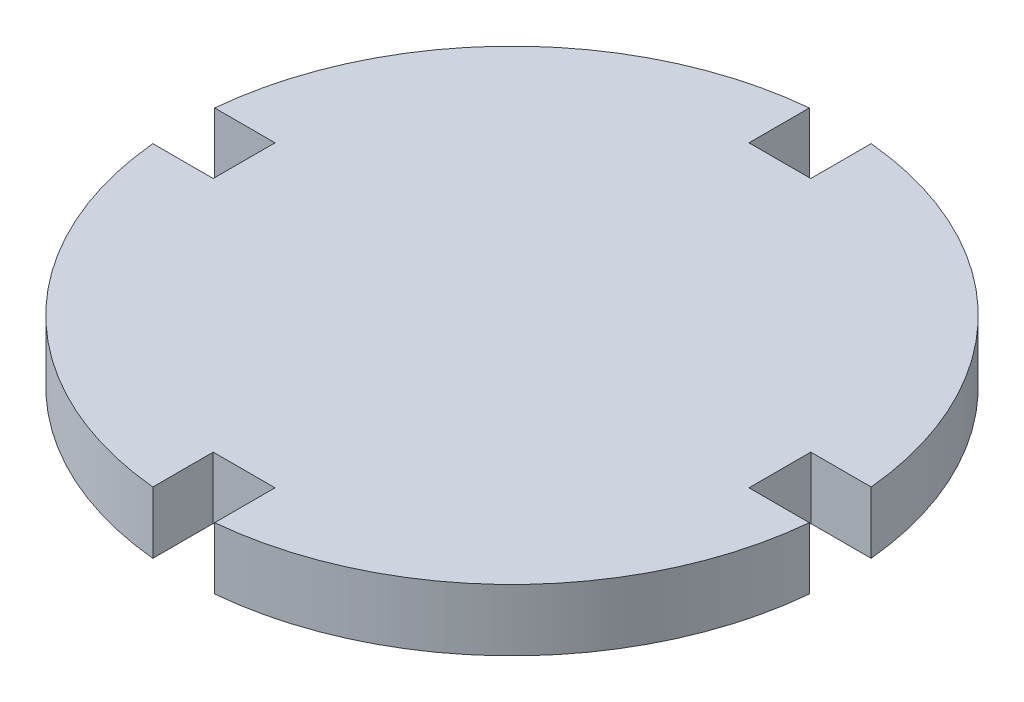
SolidWorks part; units mm, degrees
ref_plane "Alzado" through (0, 0, 0) normal (0, 0, 1) x (1, 0, 0)
ref_plane "Planta" through (0, 0, 0) normal (0, 1, 0) x (1, 0, 0)
ref_plane "Vista lateral" through (0, 0, 0) normal (1, 0, 0) x (0, 0, -1)
sketch "Croquis1" plane through (0, 0, 0) normal (0, 1, 0) x (1, 0, 0)
  circle A0 centre (0, 0) radius 16
  dimension "diametro" = 32
extrude "Saliente-Extruir1" add sketch "Croquis1" along normal blind 3
sketch "Croquis2" plane through (0, 3, 0) normal (0, 1, 0) x (1, 0, 0)
  line L0 (0, 0) -> (0, 16) construction
  line L2 (1.5, 19) -> (-1.5, 19)
  line L3 (1.5, 19) -> (1.5, 13)
  line L4 (1.5, 13) -> (-1.5, 13)
  line L5 (-1.5, 19) -> (-1.5, 13)
  line L6 (1.5, 19) -> (-1.5, 13) construction
  line L7 (1.5, 13) -> (-1.5, 19) construction
  circle A0 centre (0, 0) radius 16 construction
  dimension "D1" = 3
  dimension "D2" = 3
extrude "Cortar-Extruir2" cut sketch "Croquis2" against normal through all
pattern_circular "MatrizC1" count 4 over 360 about axis through (0, 0, 0) along (0, 1, 0) of "Cortar-Extruir2"
equation "\"D1@Croquis2\"=\"espesor@Saliente-Extruir1\""
equation "\"D2@Croquis2\"=\"espesor@Saliente-Extruir1\""
